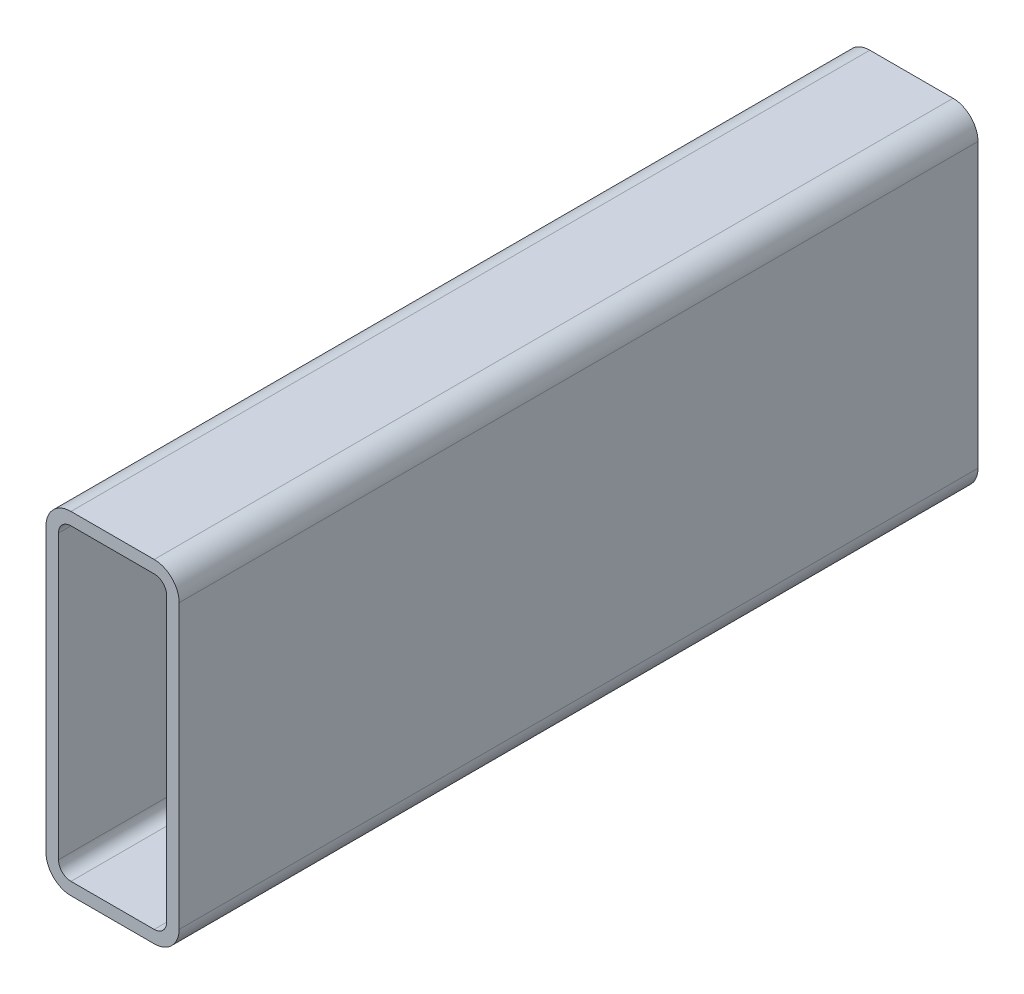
SolidWorks part; units mm, degrees
ref_plane "Front Plane" through (0, 0, 0) normal (0, 0, 1) x (1, 0, 0)
ref_plane "Top Plane" through (0, 0, 0) normal (0, 1, 0) x (1, 0, 0)
ref_plane "Right Plane" through (0, 0, 0) normal (1, 0, 0) x (0, 0, -1)
sketch "Sketch1" plane through (0, 0, 0) normal (0, 0, 1) x (1, 0, 0)
  line B0 (9.525, 127) -> (41.275, 127)
  arc B1 (50.8, 117.475) -> (41.275, 127) centre (41.275, 117.475) ccw
  line B2 (50.8, 117.475) -> (50.8, 9.525)
  arc B3 (41.275, 0) -> (50.8, 9.525) centre (41.275, 9.525) ccw
  line B4 (41.275, 0) -> (9.525, 0)
  arc B5 (0, 9.525) -> (9.525, 0) centre (9.525, 9.525) ccw
  line B6 (0, 9.525) -> (0, 117.475)
  arc B7 (9.525, 127) -> (0, 117.475) centre (9.525, 117.475) ccw
  line B8 (9.525, 122.2375) -> (41.275, 122.2375)
  arc B9 (46.0375, 117.475) -> (41.275, 122.2375) centre (41.275, 117.475) ccw
  line B10 (46.0375, 117.475) -> (46.0375, 9.525)
  arc B11 (41.275, 4.7625) -> (46.0375, 9.525) centre (41.275, 9.525) ccw
  line B12 (41.275, 4.7625) -> (9.525, 4.7625)
  arc B13 (4.7625, 9.525) -> (9.525, 4.7625) centre (9.525, 9.525) ccw
  line B14 (4.7625, 9.525) -> (4.7625, 117.475)
  arc B15 (9.525, 122.2375) -> (4.7625, 117.475) centre (9.525, 117.475) ccw
sketch_block_instance "HSS5x2x0.1875-1"
sketch_block "HSS5x2x0.1875"
extrude "Boss-Extrude1" add sketch "Sketch1" along normal blind 304.8
